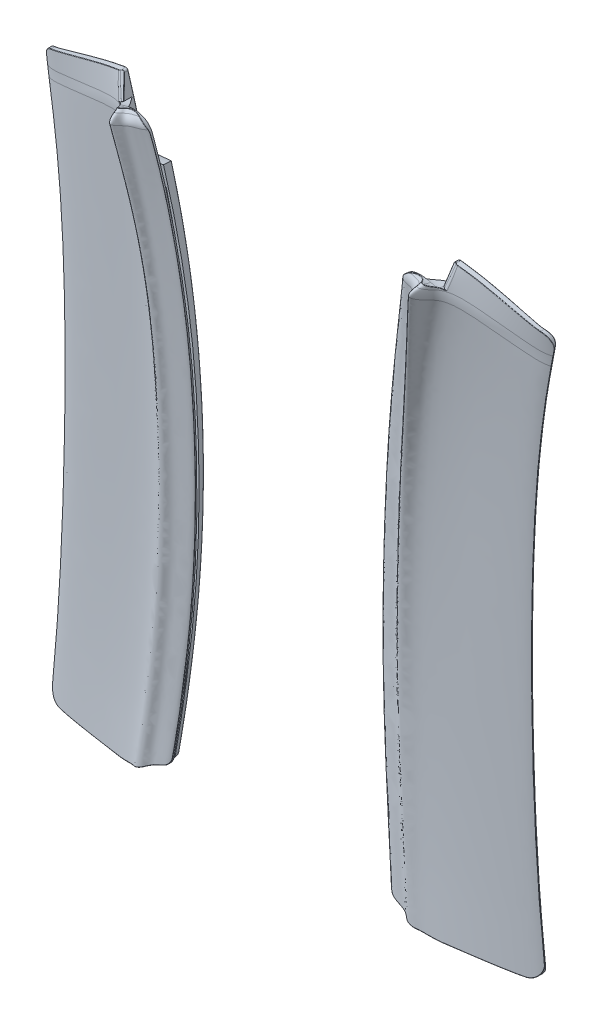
SolidWorks part; units mm, degrees
ref_plane "Front Plane" through (0, 0, 0) normal (0, 0, 1) x (1, 0, 0)
ref_plane "Top Plane" through (0, 0, 0) normal (0, 1, 0) x (1, 0, 0)
ref_plane "Right Plane" through (0, 0, 0) normal (1, 0, 0) x (0, 0, -1)
imported_body "Imported1"
fillet "Fillet3" radius 2
fillet "Fillet4" radius 1.2 1 edges
fillet "Fillet5" radius 8 2 edges
fillet "Fillet6" radius 6 2 edges
fillet "Fillet7" radius 0.25 43 edges at (-29.1778, 177.7014, -3.6577) (-18.1384, 0.3489, 2.0036) (-11.4573, -3.0315, 2.1161) (1.3678, -7.9292, 4.4794) (14.1676, -9.1117, 5.2919) (34.9645, -9.1623, 2.9261) (58.9611, -5.6332, -2.5655) (60.3066, -1.77, -1.9557) (60.3232, -0.8256, -1.8172) (65.1131, 327.3963, -2.99) (64.9889, 328.9669, -3.3593) (63.2986, 332.6295, -3.6354) (32.6626, 343.7226, -0.4952) (13.4933, 349.743, 1.6857) (11.3393, 349.836, 1.9557) (-18.7595, 302.9255, 9.1703) (8.8581, 341.4816, 6.4479) (11.1113, 349.7354, 4.3315) (13.0681, 349.6348, 5.0531) (64.4717, 330.6966, -1.809) (52.6258, 156.963, -1.2144) (57.4454, -7.3086, 0.7131) (34.9532, -9.1623, 5.6941) (5.2138, -8.6481, 10.4409) (-9.7035, -3.8209, 12.8862) (4.7566, 317.975, -0.0882) (-21.6689, 2.0965, 9.7644)
move or copy body "Body-Move/Copy1" bodies to move or copy 101 copy no translate (90, 0, 0)
mirror "Mirror2" about plane through (0, 0, 0) normal (1, 0, 0)
